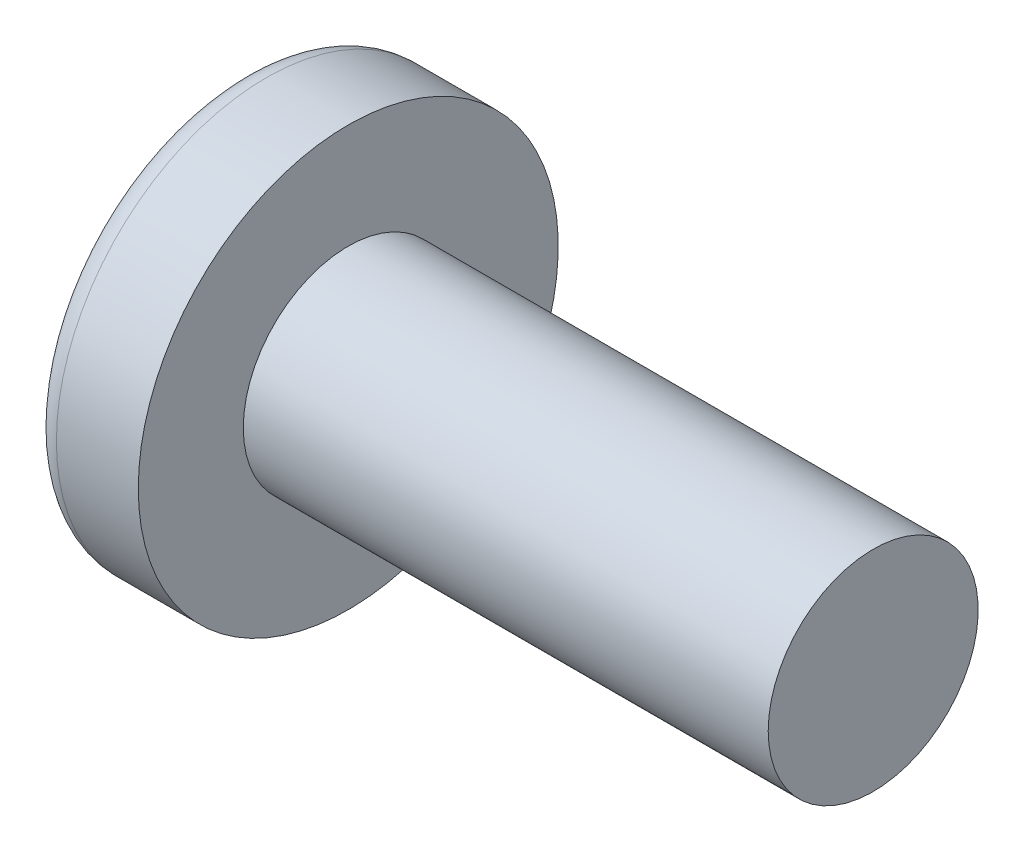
SolidWorks part; units mm, degrees
ref_plane "Front Plane" through (0, 0, 0) normal (0, 0, 1) x (1, 0, 0)
ref_plane "Top Plane" through (0, 0, 0) normal (0, 1, 0) x (1, 0, 0)
ref_plane "Right Plane" through (0, 0, 0) normal (1, 0, 0) x (0, 0, -1)
imported_body "pan cross head_am-2-solid1"
other "Move Face1" parameters "D1"=1
